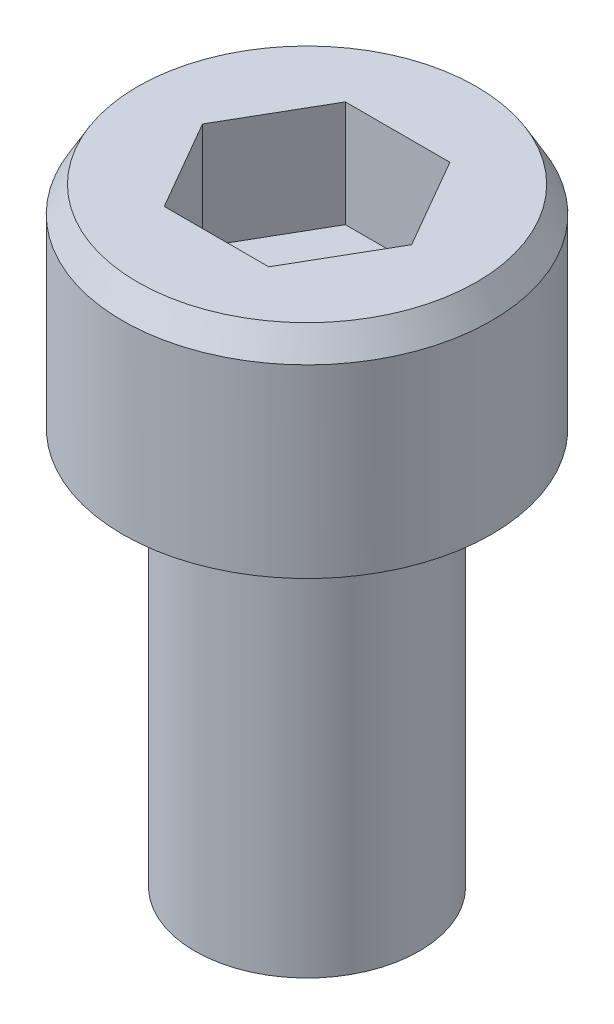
SolidWorks part; units mm, degrees
ref_plane "Front Plane" through (0, 0, 0) normal (0, 0, 1) x (1, 0, 0)
ref_plane "Top Plane" through (0, 0, 0) normal (0, 1, 0) x (1, 0, 0)
ref_plane "Right Plane" through (0, 0, 0) normal (1, 0, 0) x (0, 0, -1)
sketch "Sketch1" plane through (0, 0, 0) normal (0, 1, 0) x (1, 0, 0)
  circle A0 centre (0, 0) radius 1.7145
  dimension "D1" = 3.429
extrude "Extrude1" add sketch "Sketch1" along normal blind 6.0706
sketch "Sketch2" plane through (0, 6.0706, 0) normal (0, 1, 0) x (-1, 0, 0)
  circle A0 centre (0, 0) radius 2.8194
  dimension "D1" = 5.6388
extrude "Extrude2" add sketch "Sketch2" along normal blind 3.4544
chamfer "Chamfer1" distance 0.3969 angle 30 3 edges at (0, 0, 1.7145) (0, 6.0706, 2.8194) (0, 9.525, 2.8194)
sketch "Sketch3" plane through (0, 9.525, 0) normal (0, 1, 0) x (-1, 0, 0)
  line L0 (1.5985, 0) -> (0.7992, -1.3843)
  line L1 (0.7992, -1.3843) -> (-0.7992, -1.3843)
  line L2 (-0.7992, -1.3843) -> (-1.5985, 0)
  line L3 (-1.5985, 0) -> (-0.7992, 1.3843)
  line L4 (-0.7992, 1.3843) -> (0.7992, 1.3843)
  line L5 (0.7992, 1.3843) -> (1.5985, 0)
  line L6 (0, 1.1286) -> (0, -49998.8714) construction
  line L7 (-8.2048, 0) -> (-50008.2048, 0) construction
  dimension "D3" = 2.7686
  dimension "D7" = 120
extrude "Cut-Extrude1" cut sketch "Sketch3" against normal blind 1.6256
